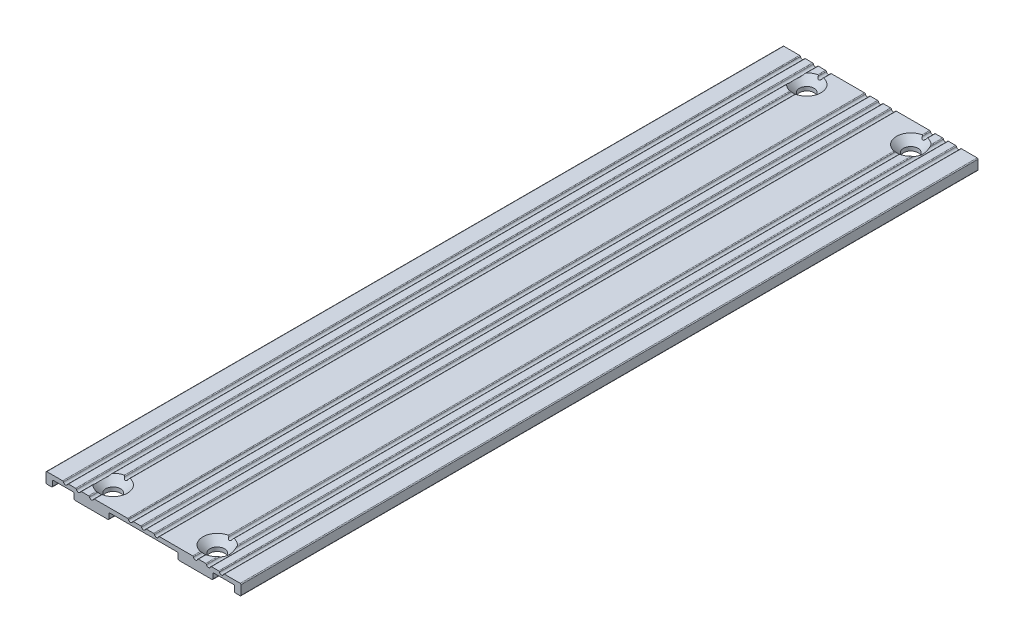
SolidWorks part; units mm, degrees
ref_plane "前视基准面" through (0, 0, 0) normal (0, 0, 1) x (1, 0, 0)
ref_plane "上视基准面" through (0, 0, 0) normal (0, 1, 0) x (1, 0, 0)
ref_plane "右视基准面" through (0, 0, 0) normal (1, 0, 0) x (0, 0, -1)
sketch "Model" plane through (0, 0, 0) normal (0, 0, 1) x (1, 0, 0)
  line L0 (24.0049, 6.6319) -> (22.3465, 6.6319)
  line L1 (27.0049, 6.6319) -> (25.3465, 6.6319)
  line L2 (36.0049, 6.6319) -> (28.3465, 6.6319)
  line L3 (39.0049, 6.6319) -> (37.3465, 6.6319)
  line L4 (42.0049, 6.6319) -> (40.3465, 6.6319)
  line L5 (47.1757, 6.6319) -> (43.3465, 6.6319)
  line L6 (2.1757, 4.1319) -> (47.1757, 4.1319)
  line L7 (2.1757, 6.6319) -> (2.1757, 4.1319)
  line L8 (9.0049, 6.6319) -> (7.3465, 6.6319)
  line L9 (12.0049, 6.6319) -> (10.3465, 6.6319)
  line L10 (21.0049, 6.6319) -> (13.3465, 6.6319)
  line L11 (6.0049, 6.6319) -> (2.1757, 6.6319)
  line L12 (47.1757, 4.1319) -> (47.1757, 6.6319)
  arc A0 (21.1965, 6.489) -> (21.0049, 6.6319) centre (21.0049, 6.4319) ccw
  arc A1 (21.1965, 6.489) -> (22.1549, 6.489) centre (21.6757, 6.6319) ccw
  arc A2 (22.3465, 6.6319) -> (22.1549, 6.489) centre (22.3465, 6.4319) ccw
  arc A3 (24.1965, 6.489) -> (24.0049, 6.6319) centre (24.0049, 6.4319) ccw
  arc A4 (24.1965, 6.489) -> (25.1549, 6.489) centre (24.6757, 6.6319) ccw
  arc A5 (25.3465, 6.6319) -> (25.1549, 6.489) centre (25.3465, 6.4319) ccw
  arc A6 (27.1965, 6.489) -> (27.0049, 6.6319) centre (27.0049, 6.4319) ccw
  arc A7 (27.1965, 6.489) -> (28.1549, 6.489) centre (27.6757, 6.6319) ccw
  arc A8 (28.3465, 6.6319) -> (28.1549, 6.489) centre (28.3465, 6.4319) ccw
  arc A9 (36.1965, 6.489) -> (36.0049, 6.6319) centre (36.0049, 6.4319) ccw
  arc A10 (36.1965, 6.489) -> (37.1549, 6.489) centre (36.6757, 6.6319) ccw
  arc A11 (37.3465, 6.6319) -> (37.1549, 6.489) centre (37.3465, 6.4319) ccw
  arc A12 (39.1965, 6.489) -> (39.0049, 6.6319) centre (39.0049, 6.4319) ccw
  arc A13 (39.1965, 6.489) -> (40.1549, 6.489) centre (39.6757, 6.6319) ccw
  arc A14 (40.3465, 6.6319) -> (40.1549, 6.489) centre (40.3465, 6.4319) ccw
  arc A15 (42.1965, 6.489) -> (42.0049, 6.6319) centre (42.0049, 6.4319) ccw
  arc A16 (42.1965, 6.489) -> (43.1549, 6.489) centre (42.6757, 6.6319) ccw
  arc A17 (43.3465, 6.6319) -> (43.1549, 6.489) centre (43.3465, 6.4319) ccw
  arc A18 (6.1965, 6.489) -> (6.0049, 6.6319) centre (6.0049, 6.4319) ccw
  arc A19 (6.1965, 6.489) -> (7.1549, 6.489) centre (6.6757, 6.6319) ccw
  arc A20 (7.3465, 6.6319) -> (7.1549, 6.489) centre (7.3465, 6.4319) ccw
  arc A21 (9.1965, 6.489) -> (9.0049, 6.6319) centre (9.0049, 6.4319) ccw
  arc A22 (9.1965, 6.489) -> (10.1549, 6.489) centre (9.6757, 6.6319) ccw
  arc A23 (10.3465, 6.6319) -> (10.1549, 6.489) centre (10.3465, 6.4319) ccw
  arc A24 (12.1965, 6.489) -> (12.0049, 6.6319) centre (12.0049, 6.4319) ccw
  arc A25 (12.1965, 6.489) -> (13.1549, 6.489) centre (12.6757, 6.6319) ccw
  arc A26 (13.3465, 6.6319) -> (13.1549, 6.489) centre (13.3465, 6.4319) ccw
  dimension "D1" = 2.5
extrude "凸台-拉伸1" add sketch "Model" along normal mid plane 170
hole_wizard "打孔尺寸根据十字槽半沉头木螺钉的类型1" positions "草图3" profile "草图2" countersink size "M3" standard "Gb"
sketch "草图3" plane through (0, 6.6319, 0) normal (0, 1, 0) x (1, 0, 0)
  line L0 (24.6757, 85) -> (24.6757, -225.6226) construction
  line L1 (25.1549, 85) -> (24.1965, 85) construction
  line L3 (6.0049, -85) -> (2.1757, -85) construction
  line L4 (6.0049, 85) -> (2.1757, 85) construction
  point P0 (12.6757, -80)
  point P2 (36.6757, -80)
  point P4 (12.6757, 80)
  point P6 (36.6757, 80)
  point P20 (4.0903, 85)
  dimension "D1" = 24
  dimension "D2" = 5
  dimension "D3" = 5
sketch "草图2" plane through (12.6757, 6.6319, 80) normal (1, 0, 0) x (0, 0, 1)
  line L0 (0, 0) -> (0, 2.5)
  line L1 (0, 2.5) -> (1.7, 2.5)
  line L2 (1.7, 2.5) -> (1.7, 1.6)
  line L3 (1.7, 1.6) -> (3.3, 0)
  line L5 (3.3, 0) -> (0, 0)
  line L6 (-1.7, 1.6) -> (-3.3, 0) construction
  line L11 (0, -6.35) -> (0, 107.95) construction
  dimension "通孔孔直径" = 3.4
  dimension "通孔孔深度" = 2.5
  dimension "近端锥形沉头孔直径" = 6.6
  dimension "近端锥形沉头孔角度" = 90
sketch "草图4" plane through (0, 0, 85) normal (0, 0, 1) x (1, 0, 0)
  line L0 (24.6757, 4.1319) -> (24.6757, 11.4806) construction
  line L1 (2.1757, 4.1319) -> (47.1757, 4.1319) construction
  line L3 (16.6757, 4.1319) -> (32.6757, 4.1319)
  line L4 (16.6757, 4.1319) -> (16.6757, 5.6319)
  line L5 (16.6757, 5.6319) -> (32.6757, 5.6319)
  line L6 (32.6757, 4.1319) -> (32.6757, 5.6319)
  line L7 (3.6757, 4.1319) -> (8.6757, 4.1319)
  line L8 (3.6757, 4.1319) -> (3.6757, 5.6319)
  line L9 (3.6757, 5.6319) -> (8.6757, 5.6319)
  line L10 (8.6757, 4.1319) -> (8.6757, 5.6319)
  line L11 (45.6757, 4.1319) -> (40.6757, 4.1319)
  line L12 (45.6757, 4.1319) -> (45.6757, 5.6319)
  line L13 (45.6757, 5.6319) -> (40.6757, 5.6319)
  line L14 (40.6757, 4.1319) -> (40.6757, 5.6319)
  dimension "D1" = 16
  dimension "D2" = 8
  dimension "D3" = 8
  dimension "D4" = 5
  dimension "D5" = 5
  dimension "D6" = 1.5
extrude "切除-拉伸1" cut sketch "草图4" against normal through all
fillet "圆角1" radius 0.2 16 edges at (3.6757, 5.6319, 0) (8.6757, 5.6319, 0) (16.6757, 5.6319, 0) (32.6757, 5.6319, 0) (40.6757, 5.6319, 0) (47.1757, 6.6319, 0) (45.6757, 5.6319, 0) (2.1757, 6.6319, 0) (45.6757, 4.1319, 0) (47.1757, 4.1319, 0) (40.6757, 4.1319, 0) (32.6757, 4.1319, 0) (16.6757, 4.1319, 0) (8.6757, 4.1319, 0) (3.6757, 4.1319, 0) (2.1757, 4.1319, 0)
